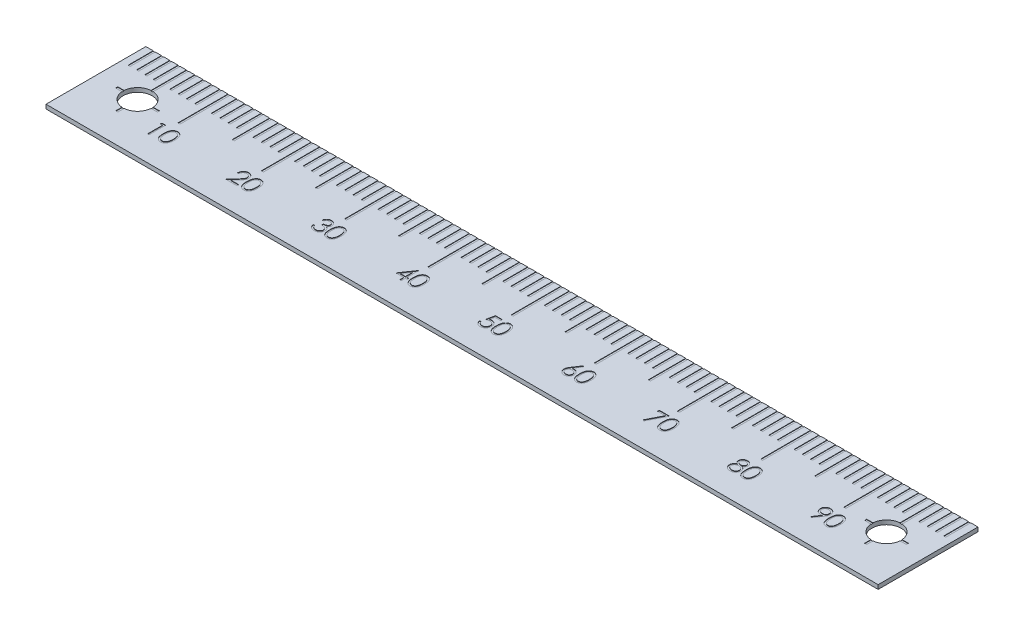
SolidWorks part; units mm, degrees
ref_plane "Front Plane" through (0, 0, 0) normal (0, 0, 1) x (1, 0, 0)
ref_plane "Top Plane" through (0, 0, 0) normal (0, 1, 0) x (1, 0, 0)
ref_plane "Right Plane" through (0, 0, 0) normal (1, 0, 0) x (0, 0, -1)
sketch "Sketch1" plane through (0, 0, 0) normal (0, 1, 0) x (1, 0, 0)
  line L1 (-50, 6) -> (50, 6)
  line L2 (-50, 6) -> (-50, -6)
  line L3 (-50, -6) -> (50, -6)
  line L4 (50, 6) -> (50, -6)
extrude "Boss-Extrude1" add sketch "Sketch1" against normal blind 0.5
sketch "Sketch2" plane through (0, 0, 0) normal (0, 1, 0) x (1, 0, 0)
  line L1 (-49.125, 3) -> (-48.875, 3)
  line L2 (-49.125, 3) -> (-49.125, 6)
  line L3 (-49.125, 6) -> (-48.875, 6)
  line L4 (-48.875, 3) -> (-48.875, 6)
  line L5 (-49, 6) -> (-49, 3) construction
  line L6 (-50, 6) -> (-50, -6) construction
  dimension "D1" = 3
  dimension "D2" = 0.25
  dimension "D3" = 1
extrude "Cut-Extrude2" cut sketch "Sketch2" against normal blind 0.05 contours L4 L3 L2 L1
pattern_linear "LPattern2" count 99 spacing 1 along (1, 0, 0) of "Cut-Extrude2"
sketch "Sketch3" plane through (0, 0, 0) normal (0, 1, 0) x (1, 0, 0)
  line L0 (-40.125, 3) -> (-40.125, 6) construction
  line L6 (-40.125, 3) -> (-39.875, 3)
  line L7 (-40.125, 3) -> (-40.125, 0)
  line L8 (-40.125, 0) -> (-39.875, 0)
  line L9 (-39.875, 3) -> (-39.875, 0)
  dimension "D1" = 0
  dimension "D2" = 0.25
  dimension "D4" = 3
extrude "Cut-Extrude3" cut sketch "Sketch3" against normal blind 0.05
pattern_linear "LPattern3" count 9 spacing 10 along (1, 0, 0) of "Cut-Extrude3"
sketch "Sketch4" plane through (0, 0, 0) normal (0, 1, 0) x (1, 0, 0)
  line L0 (-35.125, 3) -> (-35.125, 6) construction
  line L1 (-35.125, 3) -> (-34.875, 3)
  line L2 (-35.125, 3) -> (-35.125, 1.5)
  line L3 (-35.125, 1.5) -> (-34.875, 1.5)
  line L4 (-34.875, 3) -> (-34.875, 1.5)
  dimension "D1" = 0
  dimension "D2" = 0.25
  dimension "D3" = 3
  dimension "D4" = 1.5
extrude "Cut-Extrude4" cut sketch "Sketch4" against normal blind 0.05
pattern_linear "LPattern4" count 9 spacing 10 along (1, 0, 0) count 2 spacing 10 along (-1, 0, 0) of "Cut-Extrude4"
sketch "Sketch5" plane through (0, 0, 0) normal (0, 1, 0) x (1, 0, 0)
  line L0 (-44.995, 0) -> (-44.995, 2.5) construction
  line L1 (-44.995, 0) -> (-44.995, -2.5) construction
  line L2 (-44.995, 0) -> (-42.495, 0) construction
  line L3 (-44.995, 0) -> (-47.495, 0) construction
  line L5 (-45.12, 2.5) -> (-44.87, 2.5)
  line L6 (-45.12, 2.5) -> (-45.12, 1.7455)
  line L7 (-45.12, -2.5) -> (-44.87, -2.5)
  line L8 (-44.87, 2.5) -> (-44.87, 1.7455)
  line L9 (-47.495, 0.125) -> (-46.7405, 0.125)
  line L10 (-47.495, 0.125) -> (-47.495, -0.125)
  line L11 (-47.495, -0.125) -> (-46.7405, -0.125)
  line L12 (-42.495, 0.125) -> (-42.495, -0.125)
  line L13 (-48.125, 6) -> (-48.875, 6) construction
  line L14 (-45.12, 1.4948) -> (-45.12, 0.125)
  line L15 (-44.87, 1.4948) -> (-44.87, 0.125)
  line L16 (-43.2495, 0.125) -> (-42.495, 0.125)
  line L17 (-43.2495, -0.125) -> (-42.495, -0.125)
  line L18 (-44.87, -1.7455) -> (-44.87, -2.5)
  line L19 (-45.12, -1.7455) -> (-45.12, -2.5)
  line L20 (-46.4898, -0.125) -> (-45.12, -0.125)
  line L21 (-46.4898, 0.125) -> (-45.12, 0.125)
  line L22 (-44.87, -0.125) -> (-44.87, -1.4948)
  line L23 (-44.87, 0.125) -> (-43.5002, 0.125)
  line L24 (-45.12, -0.125) -> (-45.12, -1.4948)
  line L25 (-44.87, -0.125) -> (-43.5002, -0.125)
  arc A0 (-45.12, 1.4948) -> (-46.4898, 0.125) centre (-44.995, 0) ccw
  arc A1 (-45.12, 1.7455) -> (-46.7405, 0.125) centre (-44.995, 0) ccw
  arc A2 (-43.5002, 0.125) -> (-44.87, 1.4948) centre (-44.995, 0) ccw
  arc A3 (-43.2495, 0.125) -> (-44.87, 1.7455) centre (-44.995, 0) ccw
  arc A4 (-44.87, -1.4948) -> (-43.5002, -0.125) centre (-44.995, 0) ccw
  arc A5 (-44.87, -1.7455) -> (-43.2495, -0.125) centre (-44.995, 0) ccw
  arc A6 (-46.4898, -0.125) -> (-45.12, -1.4948) centre (-44.995, 0) ccw
  arc A7 (-46.7405, -0.125) -> (-45.12, -1.7455) centre (-44.995, 0) ccw
  point P34 (-44.995, 2.5)
extrude "Cut-Extrude6" cut sketch "Sketch5" against normal blind 0.05
pattern_linear "LPattern5" count 2 spacing 90 along (1, 0, 0) of "Cut-Extrude6"
sketch "Sketch7" plane through (0, 0, 0) normal (0, 1, 0) x (1, 0, 0)
  line L0 (-50, -6) -> (50, -6) construction
  line L1 (-50, 6) -> (-50, -6) construction
  text T0 "10         20         30         40" font "Century Gothic" height 2
  dimension "D1" = 3
  dimension "D2" = 8.5
extrude "Cut-Extrude7" cut sketch "Sketch7" against normal blind 0.05
sketch "Sketch11" plane through (0, 0, 0) normal (0, 1, 0) x (1, 0, 0)
  line L0 (-50, -6) -> (50, -6) construction
  line L1 (-50, 6) -> (-50, -6) construction
  text T0 "50         60         70         80         90" font "Century Gothic" height 2
  dimension "D1" = 3
  dimension "D2" = 48.5
extrude "Cut-Extrude8" cut sketch "Sketch11" against normal blind 0.05
sketch "Sketch14" plane through (0, 0, 0) normal (0, 1, 0) x (1, 0, 0)
  line L0 (-50, -6) -> (50, -6) construction
  line L1 (-50, 6) -> (-50, -6) construction
  text T0 "100       110       120       130       140" font "Century Gothic" height 2
  dimension "D1" = 3
  dimension "D2" = 97.5
extrude "Cut-Extrude10" [suppressed] cut sketch "Sketch14" against normal blind 0.05
sketch "Sketch15" plane through (0, 0, 0) normal (0, 1, 0) x (1, 0, 0)
  line L0 (-50, 6) -> (-50, -6) construction
  line L1 (-50, -6) -> (50, -6) construction
  text T0 "40         30         20         10" font "Century Gothic" height 2
  dimension "D1" = 108.5
  dimension "D2" = 3
extrude "Cut-Extrude12" [suppressed] cut sketch "Sketch15" against normal blind 0.05
sketch "Sketch18" plane through (0, 0, 0) normal (0, 1, 0) x (1, 0, 0)
  line L0 (-50, -6) -> (50, -6) construction
  line L1 (-50, 6) -> (-50, -6) construction
  text T0 "90         80         70         60         50" font "Century Gothic" height 2
  dimension "D1" = 3
  dimension "D2" = 8.5
extrude "Cut-Extrude13" [suppressed] cut sketch "Sketch18" against normal blind 0.05
sketch "Sketch19" plane through (0, 0, 0) normal (0, 1, 0) x (1, 0, 0)
  line L0 (-50, 6) -> (-50, -6) construction
  line L1 (-50, -6) -> (50, -6) construction
  text T0 "140       130       120       110       100" font "Century Gothic" height 2
  dimension "D1" = 7.5
  dimension "D2" = 3
extrude "Cut-Extrude14" [suppressed] cut sketch "Sketch19" against normal blind 0.05
sketch "Sketch20" plane through (0, 0, 0) normal (0, 1, 0) x (1, 0, 0)
  circle A0 centre (-44.995, 0) radius 1.75
extrude "Cut-Extrude15" cut sketch "Sketch20" against normal blind 0.5
pattern_linear "LPattern6" count 2 spacing 90 along (1, 0, 0) of "Cut-Extrude15"
sketch "Sketch21" plane through (0, 0, 0) normal (0, 1, 0) x (1, 0, 0)
  line L0 (-50, -6) -> (50, -6) construction
  line L1 (-50, 6) -> (-50, -6) construction
  text T0 "10         20         30         40         50         40         30         20         10" font "Century Gothic" height 2
  dimension "D1" = 3
  dimension "D2" = 8.5
extrude "Cut-Extrude17" [suppressed] cut sketch "Sketch21" against normal blind 0.05
sketch "Sketch22" plane through (0, 0, 0) normal (0, 1, 0) x (1, 0, 0)
  line L0 (-50, -6) -> (50, -6) construction
  line L1 (-50, 6) -> (-50, -6) construction
  text T0 "10         20         30         40         50         60         70         80         90        100        90         80         70         60         50         40         30         20         10" font "Century Gothic" height 2
  dimension "D1" = 3
  dimension "D2" = 8.5
extrude "Cut-Extrude18" [suppressed] cut sketch "Sketch22" against normal blind 0.05
sketch "Sketch23" plane through (0, 0, 0) normal (0, 1, 0) x (1, 0, 0)
  line L0 (-50, -6) -> (50, -6) construction
  line L2 (-50, 6) -> (-50, -6) construction
  text T0 "10         20         30         40         50         60         70         80         90        100       110       120       130       140       150       160       170       180       190       20" font "Century Gothic" height 2
  dimension "D1" = 3
  dimension "D2" = 8.5
extrude "Cut-Extrude19" [suppressed] cut sketch "Sketch23" against normal blind 0.05
sketch "Sketch24" plane through (0, 0, 0) normal (0, 1, 0) x (1, 0, 0)
  line L0 (-50, -6) -> (50, -6) construction
  line L1 (-50, 6) -> (-50, -6) construction
  text T0 "10         20         30         40         50         60         70         80         90        100       110       120       130       140       150       160       170       180       190" font "Century Gothic" height 2
  dimension "D1" = 3
  dimension "D2" = 8.5
extrude "Cut-Extrude20" [suppressed] cut sketch "Sketch24" against normal blind 0.05
sketch "Sketch26" plane through (0, 0, 0) normal (0, 1, 0) x (1, 0, 0)
  line L0 (-50, -6) -> (50, -6) construction
  line L1 (-50, 6) -> (-50, -6) construction
  text T0 "190       180       170       160       150       140       130       120       110       100        90         80         70         60         50         40         30         20         10" font "Century Gothic" height 2
  dimension "D1" = 3
  dimension "D2" = 7.5
extrude "Cut-Extrude21" [suppressed] cut sketch "Sketch26" against normal blind 0.05
sketch "Sketch27" plane through (0, 0, 0) normal (0, 1, 0) x (1, 0, 0)
  line L0 (-50, -6) -> (50, -6) construction
  line L1 (-50, 6) -> (-50, -6) construction
  text T0 "490       480       470       460       450       440       430       420       410       400       390       380       370       360       350       340       330       320       310       300       " font "Century Gothic" height 2
  dimension "D1" = 3
  dimension "D2" = 7.5
extrude "Cut-Extrude22" [suppressed] cut sketch "Sketch27" against normal blind 0.05
sketch "Sketch29" plane through (0, 0, 0) normal (0, 1, 0) x (1, 0, 0)
  line L0 (-50, -6) -> (50, -6) construction
  line L1 (-50, 6) -> (-50, -6) construction
  text T0 "10         20         30         40         50         60         70         80         90        100       110       120       130       140       150       160       170       180       190       20" font "Century Gothic" height 2
  dimension "D1" = 3
  dimension "D2" = 8.5
extrude "Cut-Extrude23" [suppressed] cut sketch "Sketch29" against normal blind 0.05
sketch "Sketch30" plane through (0, 0, 0) normal (0, 1, 0) x (1, 0, 0)
  line L0 (-50, -6) -> (50, -6) construction
  line L1 (-50, 6) -> (-50, -6) construction
  text T0 "240       230       220       210       200       190       180       170       160       150       140       130       120       110       100        90         80         70         60         50   " font "Century Gothic" height 2
  dimension "D1" = 3
  dimension "D2" = 7.5
extrude "Cut-Extrude24" [suppressed] cut sketch "Sketch30" against normal blind 0.05
sketch "Sketch31" [suppressed] plane through (0, 0, 0) normal (0, 1, 0) x (1, 0, 0)
  line L0 (-100, -6) -> (100, -6) construction
  line L1 (-100, 6) -> (-100, -6) construction
  text T0 "150       160       170       180       190" font "Century Gothic" height 2
  dimension "D1" = 3
  dimension "D2" = 148.5
extrude "Cut-Extrude25" [suppressed] cut sketch "Sketch31" against normal blind 0.05
sketch "Sketch32" [suppressed] plane through (0, 0, 0) normal (0, 1, 0) x (1, 0, 0)
  line L0 (-25, -6) -> (25, -6) construction
  line L1 (-24.125, -6) -> (-23.875, -6)
  line L2 (-24.125, -6) -> (-24.125, -3)
  line L3 (-24.125, -3) -> (-23.875, -3)
  line L4 (-23.875, -6) -> (-23.875, -3)
  line L5 (-24, -3) -> (-24, -6) construction
  line L6 (-25, 6) -> (-25, -6) construction
  dimension "D1" = 0.25
  dimension "D2" = 3
  dimension "D3" = 1
extrude "Cut-Extrude26" [suppressed] cut sketch "Sketch32" against normal blind 0.05
pattern_linear "LPattern7" [suppressed] count 99 spacing 1
sketch "Sketch34" [suppressed] plane through (0, 0, 0) normal (0, 1, 0) x (1, 0, 0)
  line L1 (-245.125, -3) -> (-244.875, -3)
  line L2 (-245.125, -3) -> (-245.125, -1.5)
  line L3 (-245.125, -1.5) -> (-244.875, -1.5)
  line L4 (-244.875, -3) -> (-244.875, -1.5)
  dimension "D1" = 1.5
  dimension "D2" = 0.25
extrude "Cut-Extrude27" [suppressed] cut sketch "Sketch34" against normal blind 0.05
pattern_linear "LPattern8" [suppressed] count 4 spacing 10
sketch "Sketch35" [suppressed] plane through (0, 0, 0) normal (0, 1, 0) x (1, 0, 0)
  line L1 (-240.125, -3) -> (-239.875, -3)
  line L2 (-240.125, -3) -> (-240.125, 0)
  line L3 (-240.125, 0) -> (-239.875, 0)
  line L4 (-239.875, -3) -> (-239.875, 0)
  dimension "D1" = 3
  dimension "D2" = 0.25
extrude "Cut-Extrude28" [suppressed] cut sketch "Sketch35" against normal blind 0.05
pattern_linear "LPattern9" [suppressed] count 4 spacing 10
equation "\"D2@Sketch1\"=\"D1@Sketch1\"/2"
equation "\"D4@Sketch1\"=\"D3@Sketch1\"/2"
equation "\"D8@Sketch5\"=\"D7@Sketch5\"/2"
equation "\"D10@Sketch5\"=\"D9@Sketch5\"/2"
